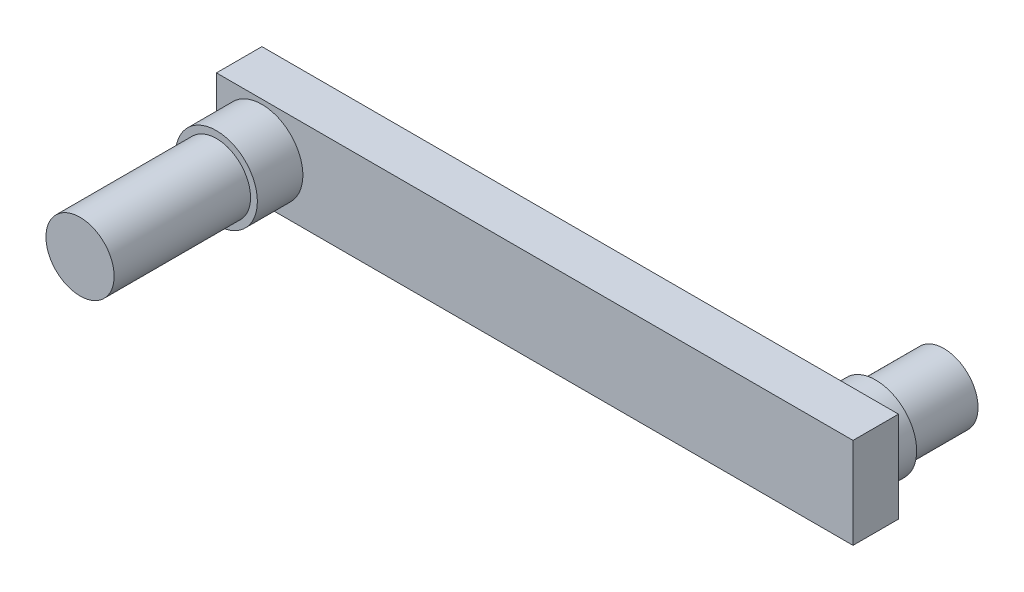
SolidWorks part; units mm, degrees
ref_plane "正面" through (0, 0, 0) normal (0, 0, 1) x (1, 0, 0)
ref_plane "平面" through (0, 0, 0) normal (0, 1, 0) x (1, 0, 0)
ref_plane "右側面" through (0, 0, 0) normal (1, 0, 0) x (0, 0, -1)
sketch "ｽｹｯﾁ1" plane through (0, 0, 0) normal (0, 0, 1) x (1, 0, 0)
  line L1 (0, 0) -> (140, 0)
  line L2 (0, 0) -> (0, 20)
  line L3 (0, 20) -> (140, 20)
  line L4 (140, 0) -> (140, 20)
  dimension "D1" = 140
  dimension "D2" = 20
extrude "押し出し1" add sketch "ｽｹｯﾁ1" along normal blind 10
sketch "ｽｹｯﾁ2" plane through (0, 0, 10) normal (0, 0, 1) x (1, 0, 0)
  line L0 (0, 0) -> (140, 0) construction
  line L2 (0, 20) -> (0, 0) construction
  circle A0 centre (10, 10) radius 9
  dimension "D1" = 18
  dimension "D2" = 10
  dimension "D3" = 10
extrude "押し出し2" add sketch "ｽｹｯﾁ2" along normal blind 10
sketch "ｽｹｯﾁ4" plane through (0, 0, 20) normal (0, 0, 1) x (1, 0, 0)
  circle A0 centre (10, 10) radius 7.5
  dimension "D1" = 15
extrude "押し出し3" add sketch "ｽｹｯﾁ4" along normal blind 30
sketch "ｽｹｯﾁ5" plane through (0, 0, 0) normal (0, 0, -1) x (-1, 0, 0)
  line L0 (0, 0) -> (-140, 0) construction
  line L2 (-140, 0) -> (-140, 20) construction
  circle A0 centre (-130, 10) radius 9
  dimension "D1" = 18
  dimension "D2" = 10
  dimension "D3" = 10
extrude "押し出し4" add sketch "ｽｹｯﾁ5" along normal blind 5
sketch "ｽｹｯﾁ6" plane through (0, 0, -5) normal (0, 0, -1) x (-1, 0, 0)
  circle A0 centre (-130, 10) radius 7.5
  dimension "D1" = 15
extrude "押し出し5" add sketch "ｽｹｯﾁ6" along normal blind 15
